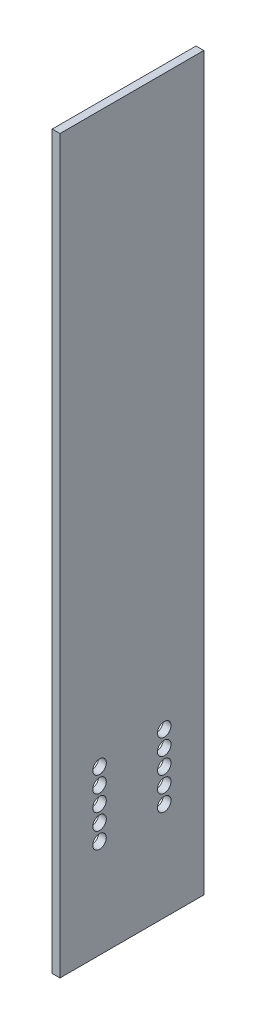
SolidWorks part; units mm, degrees
ref_plane "Front Plane" through (0, 0, 0) normal (0, 0, 1) x (1, 0, 0)
ref_plane "Top Plane" through (0, 0, 0) normal (0, 1, 0) x (1, 0, 0)
ref_plane "Right Plane" through (0, 0, 0) normal (1, 0, 0) x (0, 0, -1)
sketch "Sketch1" plane through (0, 0, 0) normal (1, 0, 0) x (0, 0, -1)
  line L1 (-28.2194, 143.51) -> (28.2194, 143.51)
  line L2 (-28.2194, 143.51) -> (-28.2194, -143.51)
  line L3 (-28.2194, -143.51) -> (28.2194, -143.51)
  line L4 (28.2194, 143.51) -> (28.2194, -143.51)
  line L5 (-28.2194, 143.51) -> (28.2194, -143.51) construction
  line L6 (-28.2194, -143.51) -> (28.2194, 143.51) construction
  point P0 (0, 0)
extrude "Boss-Extrude1" add sketch "Sketch1" along normal blind 3.048
sketch "Sketch2" plane through (3.048, 0, 0) normal (1, 0, 0) x (0, 0, -1)
  line L0 (0, 143.51) -> (0, -143.51) construction
  line L1 (28.2194, 143.51) -> (-28.2194, 143.51) construction
  line L2 (-28.2194, -143.51) -> (28.2194, -143.51) construction
  point P0 (-12.7, -98.5012)
  point P9 (12.7, -98.5012)
hole_wizard "#4 (0.209) Diameter Hole1" positions "Sketch3" profile "Sketch4" hole size "#4" standard "ANSI Inch"
sketch "Sketch3" plane through (3.048, 0, 0) normal (1, 0, 0) x (0, 0, -1)
  point P0 (-12.7, -98.5012)
  point P3 (12.7, -98.5012)
sketch "Sketch4" plane through (3.048, -98.5012, 12.7) normal (0, 1, 0) x (0, 0, -1)
  line L0 (0, 0) -> (0, 3.048)
  line L1 (0, 3.048) -> (2.6543, 3.048)
  line L2 (2.6543, 3.048) -> (2.6543, 0)
  line L5 (2.6543, 0) -> (0, 0)
  line L11 (0, -6.35) -> (0, 107.95) construction
  dimension "Thru Hole Dia." = 5.3086
  dimension "Thru Hole Depth" = 3.048
pattern_linear "LPattern1" count 4 spacing 6.35 along (0, 1, 0) count 2 spacing 6.35 along (0, -1, 0) of "#4 (0.209) Diameter Hole1"
equation "\"motor offset\"=6mm"
equation "\"thickness0.25\"=0.225in"
equation "\"thickness0.125\"=0.122in"
equation "\"thickness_acrylic0.1\"= 0.1in"
equation "\"D1@Sketch1\"=\"thickness_acrylic0.1\"+\"thickness0.125\"+2"
equation "\"D2@Sketch2\"=\"thickness0.125\" + 0.5 + 1.15"
